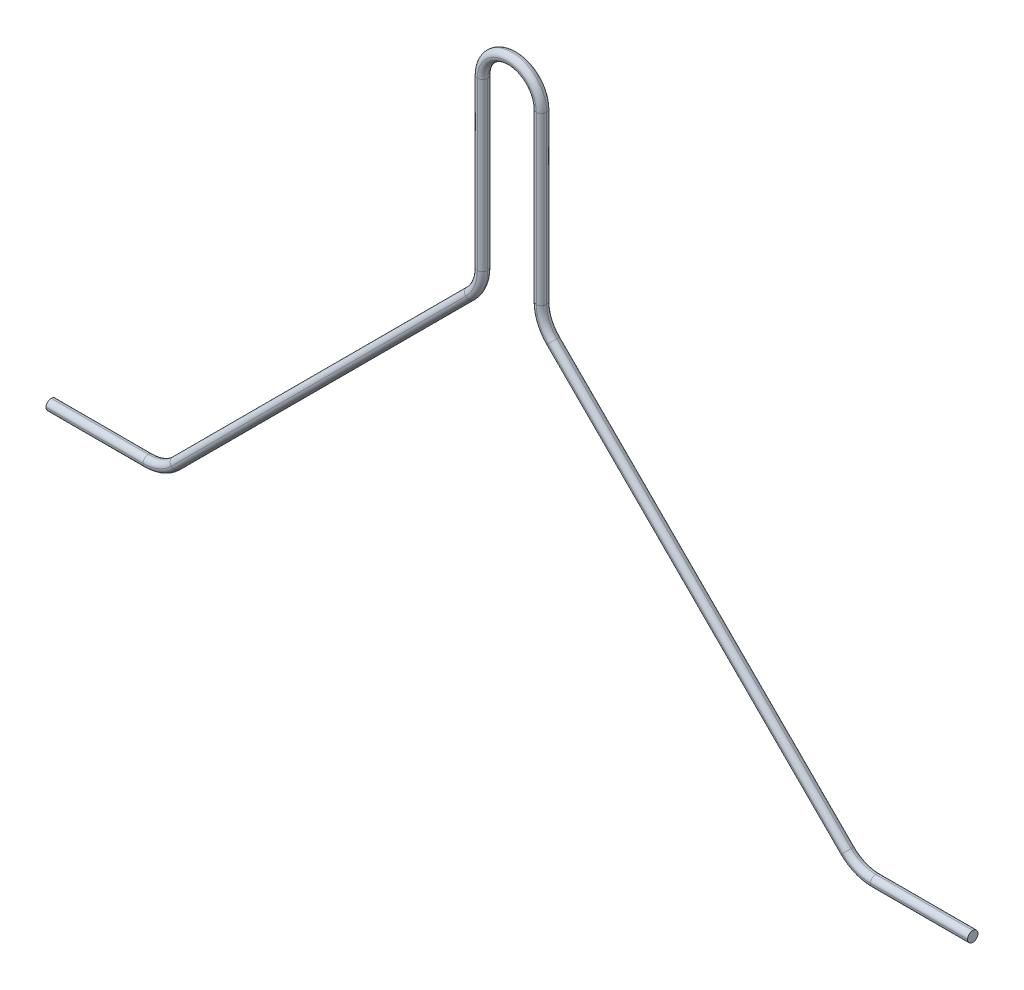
SolidWorks part; units mm, degrees
ref_plane "Спереди" through (0, 0, 0) normal (0, 0, 1) x (1, 0, 0)
ref_plane "Сверху" through (0, 0, 0) normal (0, 1, 0) x (1, 0, 0)
ref_plane "Справа" through (0, 0, 0) normal (1, 0, 0) x (0, 0, -1)
sketch "Эскиз1" plane through (0, 0, 0) normal (0, 0, 1) x (1, 0, 0)
  line L0 (-5, 0) -> (5, 0) construction
  line L1 (5, 0) -> (5, -24)
  line L2 (-5, 0) -> (-5, -24)
  line L3 (-10, -24) -> (10, -24) construction
  line L4 (10, -24) -> (0, -34) construction
  line L5 (0, -34) -> (-10, -24) construction
  line L6 (0, 0) -> (0, -34) construction
  line L7 (6.4645, -27.5355) -> (50.3553, -71.4264) construction
  line L8 (-6.4645, -27.5355) -> (-50.3553, -71.4264) construction
  line L9 (-66.4264, -71.4264) -> (66.4264, -71.4264) construction
  line L10 (-6.4645, -27.5355) -> (-48.8909, -69.9619)
  line L11 (6.4645, -27.5355) -> (48.8909, -69.9619)
  line L12 (52.4264, -71.4264) -> (66.4264, -71.4264)
  line L13 (-66.4264, -71.4264) -> (-52.4264, -71.4264)
  line L14 (-66.4264, -72.9264) -> (-52.4264, -72.9264)
  line L15 (-5.4038, -28.5962) -> (-47.8302, -71.0226)
  line L16 (-3.5, 0) -> (-3.5, -24)
  line L17 (3.5, 0) -> (3.5, -24)
  line L18 (5.4038, -28.5962) -> (47.8302, -71.0226)
  line L19 (52.4264, -72.9264) -> (66.4264, -72.9264)
  line L20 (66.4264, -71.4264) -> (66.4264, -72.9264)
  line L21 (-66.4264, -71.4264) -> (-66.4264, -72.9264)
  arc A0 (-5, 0) -> (5, 0) centre (0, 0) cw
  arc A1 (5, -24) -> (6.4645, -27.5355) centre (10, -24) ccw
  arc A2 (-5, -24) -> (-6.4645, -27.5355) centre (-10, -24) cw
  arc A3 (48.8909, -69.9619) -> (52.4264, -71.4264) centre (52.4264, -66.4264) ccw
  arc A4 (-48.8909, -69.9619) -> (-52.4264, -71.4264) centre (-52.4264, -66.4264) cw
  arc A5 (-47.8302, -71.0226) -> (-52.4264, -72.9264) centre (-52.4264, -66.4264) cw
  arc A6 (-3.5, -24) -> (-5.4038, -28.5962) centre (-10, -24) cw
  arc A7 (-3.5, 0) -> (3.5, 0) centre (0, 0) cw
  arc A8 (3.5, -24) -> (5.4038, -28.5962) centre (10, -24) ccw
  arc A9 (47.8302, -71.0226) -> (52.4264, -72.9264) centre (52.4264, -66.4264) ccw
  dimension "D6" = 5
  dimension "D7" = 5
  dimension "D1" = 5
  dimension "D2" = 24
  dimension "D3" = 45
  dimension "D4" = 45
  dimension "D5" = 10
  dimension "D8" = 60
  dimension "D9" = 14
  dimension "D10" = 14
  dimension "D12" = 10
  dimension "D11" = 1.5
extrude "Бобышка-Вытянуть1" add sketch "Эскиз1" along normal blind 1.5
fillet "Скругление1" radius 0.75 44 edges at (59.4264, -72.9264, 0) (49.939, -72.4316, 0) (26.617, -49.8094, 0) (3.9948, -26.4874, 0) (3.5, -12, 0) (0, 3.5, 0) (-3.5, -12, 0) (-3.9948, -26.4874, 0) (-26.617, -49.8094, 0) (-49.939, -72.4316, 0) (59.4264, -71.4264, 0) (50.513, -71.0458, 0) (27.6777, -48.7487, 0) (5.3806, -25.9134, 0) (5, -12, 0) (0, 5, 0) (-5, -12, 0) (-5.3806, -25.9134, 0) (-27.6777, -48.7487, 0) (-50.513, -71.0458, 0) (59.4264, -72.9264, 1.5) (49.939, -72.4316, 1.5) (26.617, -49.8094, 1.5) (3.9948, -26.4874, 1.5) (3.5, -12, 1.5) (0, 3.5, 1.5) (-3.5, -12, 1.5) (-3.9948, -26.4874, 1.5) (-26.617, -49.8094, 1.5) (-49.939, -72.4316, 1.5) (59.4264, -71.4264, 1.5) (50.513, -71.0458, 1.5) (27.6777, -48.7487, 1.5) (5.3806, -25.9134, 1.5) (5, -12, 1.5) (0, 5, 1.5) (-5, -12, 1.5) (-5.3806, -25.9134, 1.5) (-27.6777, -48.7487, 1.5) (-50.513, -71.0458, 1.5) (-59.4264, -72.9264, 0) (-59.4264, -71.4264, 0) (-59.4264, -72.9264, 1.5) (-59.4264, -71.4264, 1.5)
